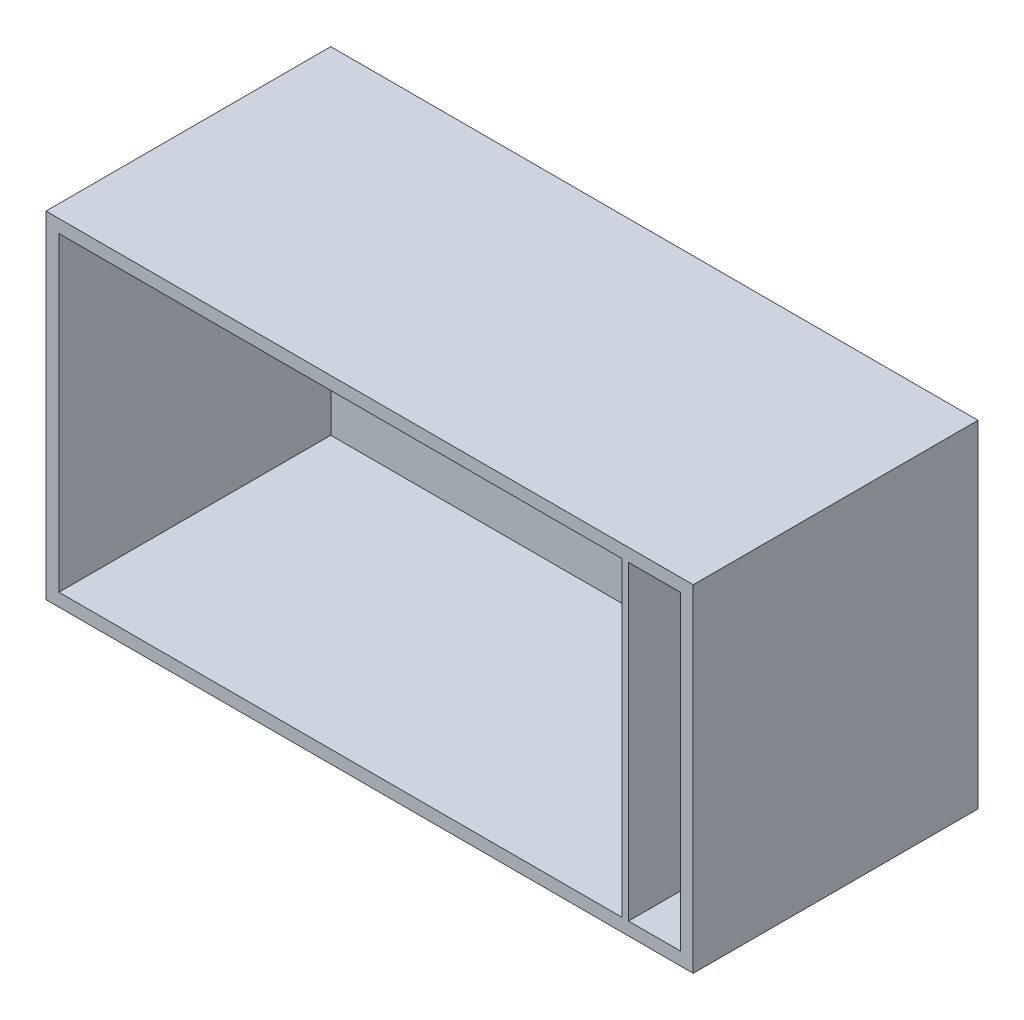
SolidWorks part; units mm, degrees
ref_plane "Front Plane" through (0, 0, 0) normal (0, 0, 1) x (1, 0, 0)
ref_plane "Top Plane" through (0, 0, 0) normal (0, 1, 0) x (1, 0, 0)
ref_plane "Right Plane" through (0, 0, 0) normal (1, 0, 0) x (0, 0, -1)
sketch "Sketch1" plane through (0, 0, 0) normal (0, 0, 1) x (1, 0, 0)
  line L0 (-12.7, -12.7) -> (622.3, -12.7)
  line L1 (0, 0) -> (609.6, 0)
  line L2 (0, 0) -> (0, 304.8)
  line L3 (0, 304.8) -> (609.6, 304.8)
  line L4 (609.6, 0) -> (609.6, 304.8)
  line L5 (622.3, -12.7) -> (622.3, 317.5)
  line L6 (-12.7, 317.5) -> (622.3, 317.5)
  line L7 (-12.7, -12.7) -> (-12.7, 317.5)
  dimension "D1" = 609.6
  dimension "D2" = 304.8
  dimension "D3" = 12.7
extrude "Extrude1" add sketch "Sketch1" along normal blind 266.7
sketch "Sketch2" plane through (0, 0, 0) normal (0, 0, -1) x (-1, 0, 0)
  line L1 (-622.3, 317.5) -> (12.7, 317.5)
  line L2 (-622.3, 317.5) -> (-622.3, -12.7)
  line L3 (-622.3, -12.7) -> (12.7, -12.7)
  line L4 (12.7, 317.5) -> (12.7, -12.7)
extrude "Extrude2" add sketch "Sketch2" along normal blind 12.7
sketch "Sketch3" plane through (0, 0, 0) normal (0, 0, 1) x (1, 0, 0)
  line L0 (609.6, 304.8) -> (0, 304.8) construction
  line L1 (552.45, 304.8) -> (558.8, 304.8)
  line L2 (552.45, 304.8) -> (552.45, 0)
  line L3 (552.45, 0) -> (558.8, 0)
  line L4 (558.8, 304.8) -> (558.8, 0)
  line L5 (0, 0) -> (609.6, 0) construction
  line L6 (609.6, 0) -> (609.6, 304.8) construction
  dimension "D1" = 50.8
  dimension "D2" = 6.35
extrude "Extrude3" add sketch "Sketch3" along normal up to surface (266.7 mm away)
